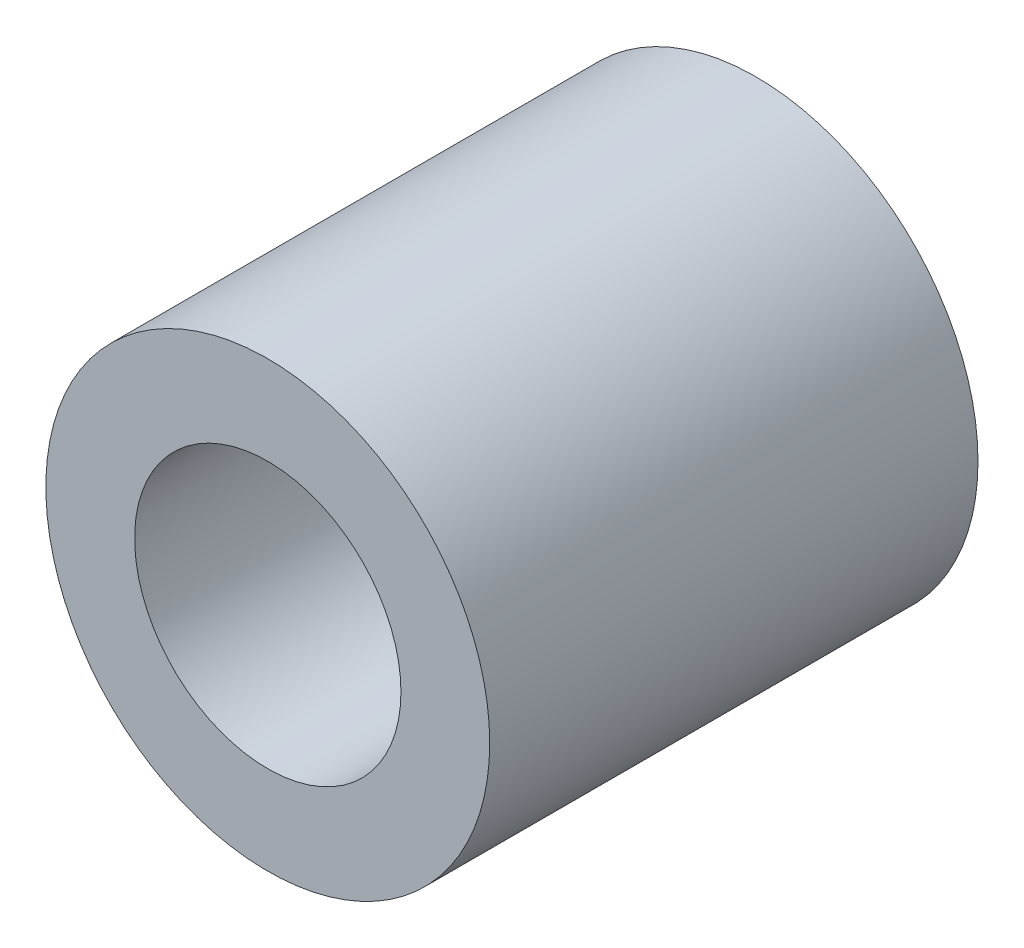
SolidWorks part; units mm, degrees
ref_plane "Plan de face" through (0, 0, 0) normal (0, 0, 1) x (1, 0, 0)
ref_plane "Plan de dessus" through (0, 0, 0) normal (0, 1, 0) x (1, 0, 0)
ref_plane "Plan de droite" through (0, 0, 0) normal (1, 0, 0) x (0, 0, -1)
sketch "Esquisse1" plane through (0, 0, 0) normal (0, 0, 1) x (1, 0, 0)
  circle A0 centre (0, 0) radius 3
  circle A1 centre (0, 0) radius 5
  dimension "D1" = 10
  dimension "D2" = 6
extrude "Extrusion1" add sketch "Esquisse1" along normal blind 11
